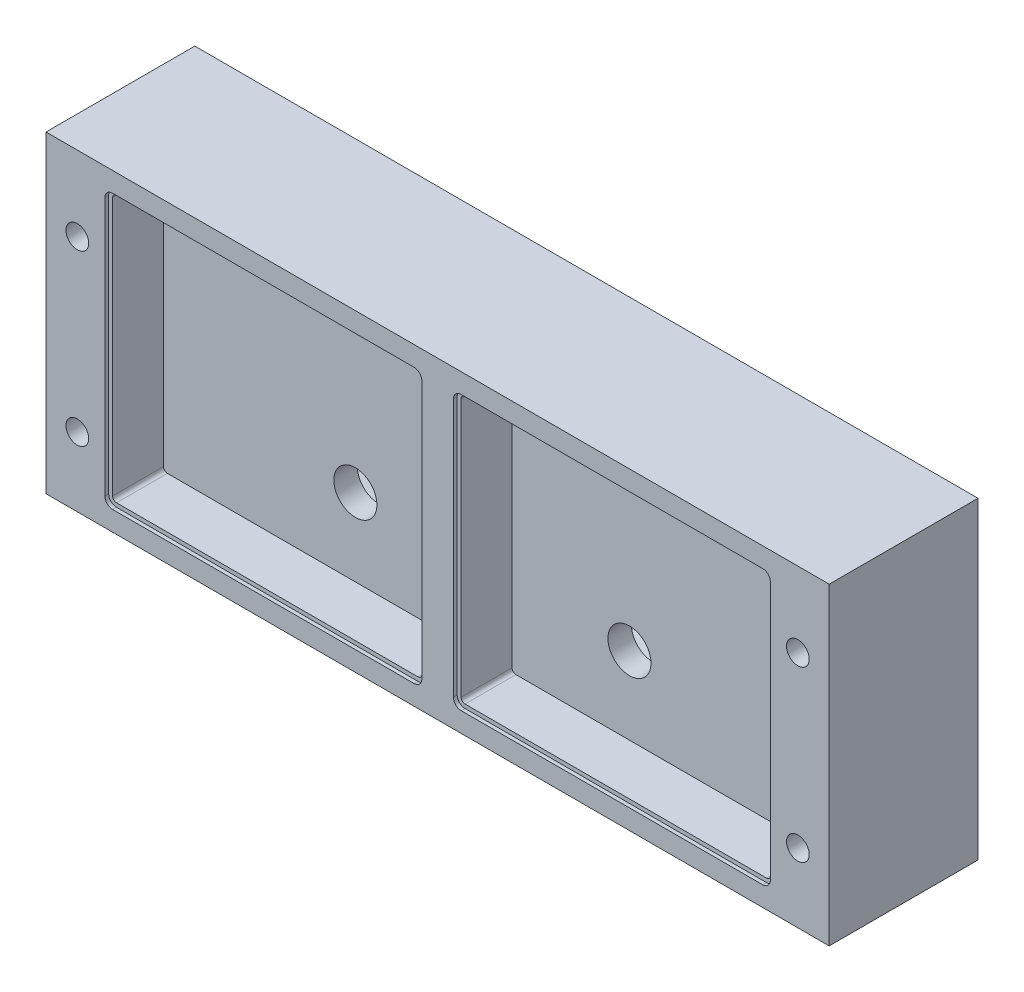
SolidWorks part; units mm, degrees
ref_plane "Front Plane" through (0, 0, 0) normal (0, 0, 1) x (1, 0, 0)
ref_plane "Top Plane" through (0, 0, 0) normal (0, 1, 0) x (1, 0, 0)
ref_plane "Right Plane" through (0, 0, 0) normal (1, 0, 0) x (0, 0, -1)
sketch "Sketch1" plane through (0, 0, 0) normal (0, 0, 1) x (1, 0, 0)
  line L1 (-33.75, 21.5625) -> (66.25, 21.5625)
  line L2 (-33.75, 21.5625) -> (-33.75, -18.4375)
  line L3 (-33.75, -18.4375) -> (66.25, -18.4375)
  line L4 (66.25, 21.5625) -> (66.25, -18.4375)
  dimension "D1" = 100
  dimension "D2" = 40
extrude "Boss-Extrude1" add sketch "Sketch1" along normal blind 38
sketch "Sketch2" plane through (0, 0, 0) normal (0, 0, -1) x (-1, 0, 0)
  line L0 (-66.25, -18.4375) -> (-66.25, 21.5625) construction
  line L1 (-58.25, 18.5625) -> (-18.75, 18.5625)
  line L2 (-58.25, 18.5625) -> (-58.25, -15.4375)
  line L3 (-58.25, -15.4375) -> (-18.75, -15.4375)
  line L4 (-18.75, 18.5625) -> (-18.75, -15.4375)
  line L5 (-13.75, 18.5625) -> (25.75, 18.5625)
  line L6 (-13.75, 18.5625) -> (-13.75, -15.4375)
  line L7 (-13.75, -15.4375) -> (25.75, -15.4375)
  line L8 (25.75, 18.5625) -> (25.75, -15.4375)
  line L9 (33.75, 21.5625) -> (33.75, -18.4375) construction
  line L10 (-66.25, 21.5625) -> (33.75, 21.5625) construction
  line L11 (33.75, -18.4375) -> (-66.25, -18.4375) construction
  dimension "D1" = 8
  dimension "D2" = 8
  dimension "D3" = 5
  dimension "D4" = 3
  dimension "D5" = 3
  dimension "D6" = 3
  dimension "D7" = 3
  dimension "D8" = 39.5
  dimension "D9" = 39.5
extrude "Cut-Extrude2" cut sketch "Sketch2" against normal blind 21 from offset 12
sketch "Sketch4" plane through (0, 0, 0) normal (0, 0, -1) x (-1, 0, 0)
  line L0 (-66.25, -18.4375) -> (-66.25, 21.5625) construction
  line L1 (33.75, 21.5625) -> (33.75, -18.4375) construction
  circle A0 centre (-62.25, 11.9848) radius 1.45
  circle A1 centre (-62.25, -9.6166) radius 1.45
  circle A2 centre (29.75, 11.9848) radius 1.45
  circle A3 centre (29.75, -9.6166) radius 1.45
  dimension "D1" = 4
  dimension "D2" = 4
extrude "Cut-Extrude4" cut sketch "Sketch4" against normal up to next
sketch "Sketch6" plane through (0, 21.5625, 0) normal (0, 1, 0) x (1, 0, 0)
  line L0 (-33.75, -38) -> (-33.75, 0) construction
  line L1 (66.25, -38) -> (-33.75, -38)
  line L2 (66.25, -38) -> (66.25, -19)
  line L3 (66.25, -19) -> (-33.75, -19)
  line L4 (-33.75, -38) -> (-33.75, -19)
extrude "Cut-Extrude5" cut sketch "Sketch6" against normal through all
fillet "Fillet1" radius 0.5 8 edges at (58.25, 18.5625, 15.5) (58.25, -15.4375, 15.5) (18.75, -15.4375, 15.5) (18.75, 18.5625, 15.5) (13.75, 18.5625, 15.5) (13.75, -15.4375, 15.5) (-25.75, -15.4375, 15.5) (-25.75, 18.5625, 15.5)
sketch "Sketch10" plane through (0, 0, 12) normal (0, 0, 1) x (1, 0, 0)
  line L8 (14.25, -14.9375) -> (14.25, 18.0625)
  line L9 (13.25, 19.0625) -> (-25.25, 19.0625)
  line L10 (-26.25, 18.0625) -> (-26.25, -14.9375)
  line L11 (-25.25, -15.9375) -> (13.25, -15.9375)
  line L12 (14.25, -14.9375) -> (14.25, 18.0625)
  line L13 (13.25, 19.0625) -> (-25.25, 19.0625)
  line L14 (-26.25, 18.0625) -> (-26.25, -14.9375)
  line L15 (-25.25, -15.9375) -> (13.25, -15.9375)
  arc A8 (14.25, 18.0625) -> (13.25, 19.0625) centre (13.25, 18.0625) ccw
  arc A9 (-25.25, 19.0625) -> (-26.25, 18.0625) centre (-25.25, 18.0625) ccw
  arc A10 (-26.25, -14.9375) -> (-25.25, -15.9375) centre (-25.25, -14.9375) ccw
  arc A11 (13.25, -15.9375) -> (14.25, -14.9375) centre (13.25, -14.9375) ccw
  arc A12 (14.25, 18.0625) -> (13.25, 19.0625) centre (13.25, 18.0625) ccw
  arc A13 (-25.25, 19.0625) -> (-26.25, 18.0625) centre (-25.25, 18.0625) ccw
  arc A14 (-26.25, -14.9375) -> (-25.25, -15.9375) centre (-25.25, -14.9375) ccw
  arc A15 (13.25, -15.9375) -> (14.25, -14.9375) centre (13.25, -14.9375) ccw
  dimension "D1" = 0.5
extrude "Cut-Extrude6" cut sketch "Sketch10" along normal blind 0.5 draft 2 from offset 6.5
sketch "Sketch11" plane through (0, 0, 12) normal (0, 0, 1) x (1, 0, 0)
  line L8 (58.75, -14.9375) -> (58.75, 18.0625)
  line L9 (57.75, 19.0625) -> (19.25, 19.0625)
  line L10 (18.25, 18.0625) -> (18.25, -14.9375)
  line L11 (19.25, -15.9375) -> (57.75, -15.9375)
  line L12 (58.75, -14.9375) -> (58.75, 18.0625)
  line L13 (57.75, 19.0625) -> (19.25, 19.0625)
  line L14 (18.25, 18.0625) -> (18.25, -14.9375)
  line L15 (19.25, -15.9375) -> (57.75, -15.9375)
  arc A8 (58.75, 18.0625) -> (57.75, 19.0625) centre (57.75, 18.0625) ccw
  arc A9 (19.25, 19.0625) -> (18.25, 18.0625) centre (19.25, 18.0625) ccw
  arc A10 (18.25, -14.9375) -> (19.25, -15.9375) centre (19.25, -14.9375) ccw
  arc A11 (57.75, -15.9375) -> (58.75, -14.9375) centre (57.75, -14.9375) ccw
  arc A12 (58.75, 18.0625) -> (57.75, 19.0625) centre (57.75, 18.0625) ccw
  arc A13 (19.25, 19.0625) -> (18.25, 18.0625) centre (19.25, 18.0625) ccw
  arc A14 (18.25, -14.9375) -> (19.25, -15.9375) centre (19.25, -14.9375) ccw
  arc A15 (57.75, -15.9375) -> (58.75, -14.9375) centre (57.75, -14.9375) ccw
  dimension "D1" = 0.5
extrude "Cut-Extrude7" cut sketch "Sketch11" along normal blind 0.5 draft 2 from offset 6.5
sketch "Sketch12" plane through (0, 0, 0) normal (0, 0, -1) x (-1, 0, 0)
  line L0 (-16.25, 21.5625) -> (-16.25, -22.3017) construction
  line L1 (-66.25, 21.5625) -> (33.75, 21.5625) construction
  line L2 (-66.25, -18.4375) -> (-66.25, 21.5625) construction
  line L3 (-66.25, -8.4375) -> (34.7654, -8.4375) construction
  line L4 (33.75, -18.4375) -> (-66.25, -18.4375) construction
  line L5 (-66.25, 7.0359) -> (33.75, 7.0359) construction
  line L6 (33.75, 21.5625) -> (33.75, -18.4375) construction
  line L7 (-16.25, 21.5625) -> (-16.25, 58.6816) construction
  arc A0 (-53.6512, 7.0359) -> (21.1512, 7.0359) centre (-16.25, 44.305) ccw construction
  arc A1 (-57.8659, 2.8361) -> (25.3659, 2.8361) centre (-16.25, 44.305) ccw
  arc A2 (-49.4365, 11.2357) -> (16.9365, 11.2357) centre (-16.25, 44.305) ccw
  arc A3 (-49.4365, 11.2357) -> (-57.8659, 2.8361) centre (-53.6512, 7.0359) ccw
  arc A4 (25.3659, 2.8361) -> (16.9365, 11.2357) centre (21.1512, 7.0359) ccw
  point P17 (-16.25, -8.495)
  dimension "D2" = 52.8
  dimension "D3" = 74.8024
  dimension "D1" = 10
  dimension "D4" = 22.7425
extrude "Cut-Extrude8" cut sketch "Sketch12" against normal blind 9
sketch "Sketch14" plane through (0, 0, 9) normal (0, 0, -1) x (-1, 0, 0)
  line L0 (-16.25, -8.5375) -> (-16.25, 44.2625) construction
  line L1 (-66.25, 21.5625) -> (33.75, 21.5625) construction
  line L2 (-66.25, -18.4375) -> (-66.25, 21.5625) construction
  circle A0 centre (-33.75, -5.5531) radius 2.75
  circle A1 centre (1.25, -5.5531) radius 2.75
  dimension "D4" = 52.8
  dimension "D6" = 17.5
  dimension "D7" = 17.5
  dimension "D1" = 22.7
  dimension "D2" = 50
  dimension "D3" = 52.8
  dimension "D5" = 52.8
extrude "Cut-Extrude9" cut sketch "Sketch14" against normal up to next
sketch "Sketch15" plane through (0, 0, 9) normal (0, 0, -1) x (-1, 0, 0)
  arc A4 (-49.4365, 11.2357) -> (-57.8659, 2.8361) centre (-53.6512, 7.0359) ccw
  arc A5 (-57.8659, 2.8361) -> (25.3659, 2.8361) centre (-16.25, 44.305) ccw
  arc A6 (25.3659, 2.8361) -> (16.9365, 11.2357) centre (21.1512, 7.0359) ccw
  arc A7 (-49.4365, 11.2357) -> (16.9365, 11.2357) centre (-16.25, 44.305) ccw
  arc A8 (-49.4365, 11.2357) -> (-57.8659, 2.8361) centre (-53.6512, 7.0359) ccw
  arc A9 (-57.8659, 2.8361) -> (25.3659, 2.8361) centre (-16.25, 44.305) ccw
  arc A10 (25.3659, 2.8361) -> (16.9365, 11.2357) centre (21.1512, 7.0359) ccw
  arc A11 (-49.4365, 11.2357) -> (16.9365, 11.2357) centre (-16.25, 44.305) ccw
  arc A16 (-50.1448, 10.5299) -> (-57.1576, 3.5419) centre (-53.6512, 7.0359) ccw
  arc A17 (-57.1576, 3.5419) -> (24.6576, 3.5419) centre (-16.25, 44.305) ccw
  arc A18 (24.6576, 3.5419) -> (17.6448, 10.5299) centre (21.1512, 7.0359) ccw
  arc A19 (-50.1448, 10.5299) -> (17.6448, 10.5299) centre (-16.25, 44.305) ccw
  dimension "D1" = 0
  dimension "D2" = 1
extrude "Boss-Extrude2" add sketch "Sketch15" along normal blind 1 draft 2 from offset 8
sketch "Sketch16" plane through (0, 0, 9) normal (0, 0, -1) x (-1, 0, 0)
  line L0 (-29.1543, -0.7327) -> (-29.4298, -1.694)
  line L1 (-3.3457, -0.7327) -> (-3.0702, -1.694)
  line L3 (1.4273, -10.6729) -> (1.7334, -11.6249)
  line L5 (-33.9273, -10.6729) -> (-34.2334, -11.6249)
  arc A0 (-29.4298, -1.694) -> (-3.0702, -1.694) centre (-16.25, 44.305) ccw
  arc A1 (-33.9273, -10.6729) -> (1.4273, -10.6729) centre (-16.25, 44.305) ccw
  arc A4 (-49.4365, 11.2357) -> (-57.8659, 2.8361) centre (-53.6512, 7.0359) ccw
  arc A5 (-57.8659, 2.8361) -> (25.3659, 2.8361) centre (-16.25, 44.305) ccw
  arc A6 (25.3659, 2.8361) -> (16.9365, 11.2357) centre (21.1512, 7.0359) ccw
  arc A7 (-49.4365, 11.2357) -> (16.9365, 11.2357) centre (-16.25, 44.305) ccw
  arc A9 (-34.2334, -11.6249) -> (1.7334, -11.6249) centre (-16.25, 44.305) ccw
  arc A11 (-29.1543, -0.7327) -> (-3.3457, -0.7327) centre (-16.25, 44.305) ccw
  dimension "D2" = 1
  dimension "D3" = 1
  dimension "D1" = 0
extrude "Cut-Extrude11" cut sketch "Sketch16" along normal blind 1 from offset 8
